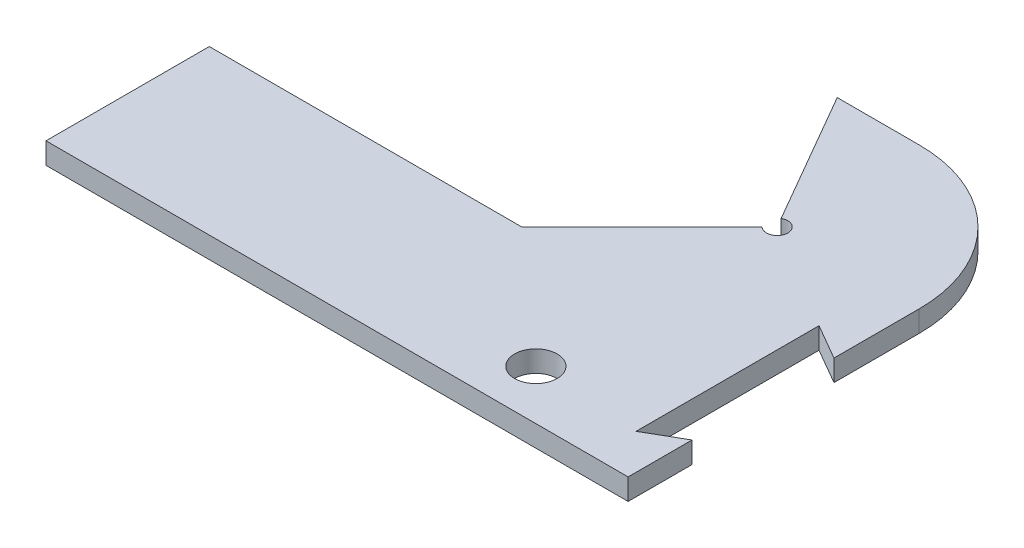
SolidWorks part; units mm, degrees
ref_plane "Front" through (0, 0, 0) normal (0, 0, 1) x (1, 0, 0)
ref_plane "Top" through (0, 0, 0) normal (0, 1, 0) x (1, 0, 0)
ref_plane "Right" through (0, 0, 0) normal (1, 0, 0) x (0, 0, -1)
sketch "Sketch1" plane through (0, 0, 0) normal (0, 1, 0) x (1, 0, 0)
  line L0 (0, 23) -> (44, 23)
  line L1 (0, 0) -> (82, 0)
  line L2 (0, 0) -> (0, 23)
  line L3 (50.453, 61) -> (62, 61)
  line L4 (82, 0) -> (82, 9)
  line L6 (77, 6.1132) -> (77, 31.8868)
  line L7 (61.25, 42.299) -> (50.453, 61)
  line L8 (60.9393, 39.9393) -> (44, 23)
  line L12 (82, 29) -> (82, 41)
  line L13 (82, 29) -> (77, 31.8868)
  line L14 (82, 9) -> (77, 6.1132)
  line L16 (0, 23) -> (82, 23) construction
  circle A0 centre (62, 7) radius 3
  arc A1 (60.9393, 39.9393) -> (61.25, 42.299) centre (62, 41) ccw
  arc A2 (82, 41) -> (62, 61) centre (62, 41) ccw
extrude "Extrude1" add sketch "Sketch1" along normal blind 3
